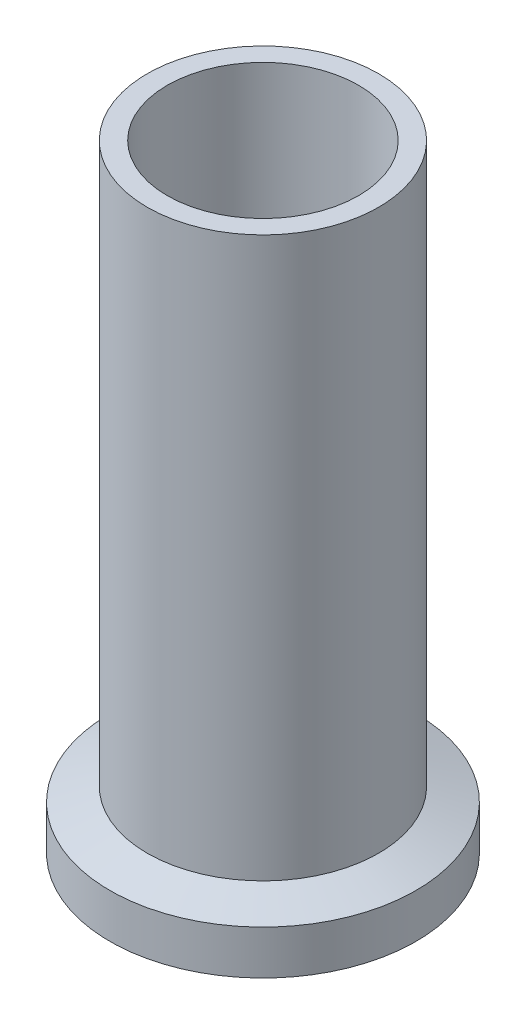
SolidWorks part; units mm, degrees
ref_plane "Front Plane" through (0, 0, 0) normal (0, 0, 1) x (1, 0, 0)
ref_plane "Top Plane" through (0, 0, 0) normal (0, 1, 0) x (1, 0, 0)
ref_plane "Right Plane" through (0, 0, 0) normal (1, 0, 0) x (0, 0, -1)
sketch "Sketch1" plane through (0, 0, 0) normal (0, 0, 1) x (1, 0, 0)
  line L0 (-7.874, 0.889) -> (-7.874, 50.8)
  line L1 (-7.874, 50.8) -> (-9.525, 50.8)
  line L2 (-9.525, 50.8) -> (-9.525, 4.7508)
  line L3 (-9.525, 4.7508) -> (-12.5984, 3.6322)
  line L4 (-12.5984, 3.6322) -> (-12.5984, 0)
  line L5 (-12.5984, 0) -> (-10.922, 0)
  line L6 (-10.922, 0) -> (-10.922, 1.3208)
  line L7 (0, 0) -> (0, 14.3564) construction
  line L9 (-8.6024, 0.889) -> (-7.874, 0.889)
  line L10 (-9.5843, 1.853) -> (-8.6024, 0.889)
  arc A2 (-9.5843, 1.853) -> (-10.922, 1.3208) centre (-10.1473, 1.3208) ccw
  dimension "D7" = 10.1473
  dimension "D1" = 50.8
  dimension "D2" = 3.6322
  dimension "D3" = 110
  dimension "D4" = 7.874
  dimension "D5" = 9.525
  dimension "D8" = 10.922
  dimension "D9" = 12.5984
revolve "Revolve1" add sketch "Sketch1" angle 360 about L7
